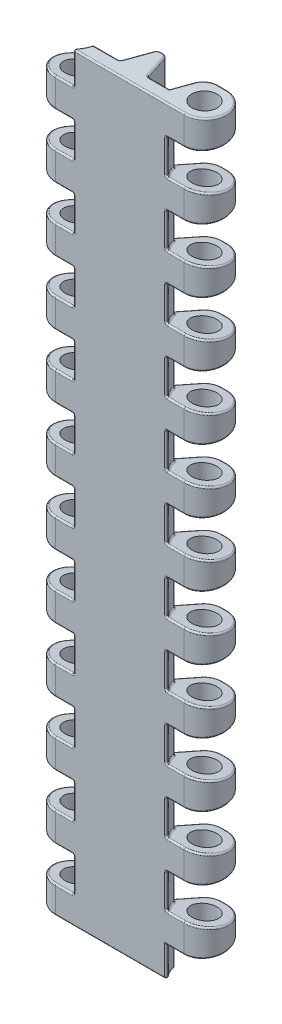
SolidWorks part; units mm, degrees
ref_plane "Ön Düzlem" through (0, 0, 0) normal (0, 0, 1) x (1, 0, 0)
ref_plane "Üst Düzlem" through (0, 0, 0) normal (0, 1, 0) x (1, 0, 0)
ref_plane "Sağ Düzlem" through (0, 0, 0) normal (1, 0, 0) x (0, 0, -1)
imported_body "Alınmış1"
imported_body "Alınmış2"
imported_body "Alınmış3"
imported_body "Alınmış4"
delete or keep bodies "Gövde-Sil1" type delete bodies bodies 102 103 104
